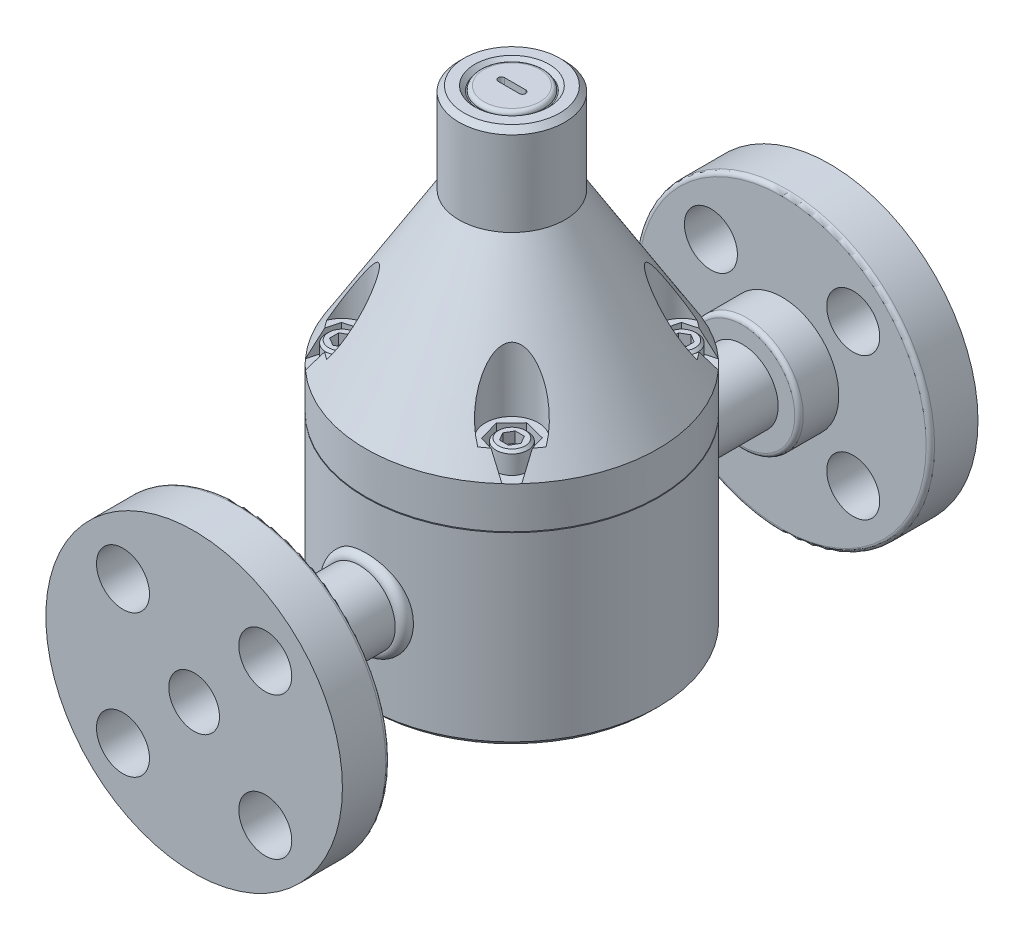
SolidWorks part; units mm, degrees
ref_plane "Front Plane" through (0, 0, 0) normal (0, 0, 1) x (1, 0, 0)
ref_plane "Top Plane" through (0, 0, 0) normal (0, 1, 0) x (1, 0, 0)
ref_plane "Right Plane" through (0, 0, 0) normal (1, 0, 0) x (0, 0, -1)
sketch "Sketch1" plane through (0, 0, 0) normal (0, 1, 0) x (1, 0, 0)
  circle A0 centre (0, 0) radius 43.815
  dimension "D1" = 87.63
extrude "Extrude1" add sketch "Sketch1" along normal blind 140.97
sketch "Sketch2" plane through (0, 0, 0) normal (0, 0, 1) x (1, 0, 0)
  line L0 (0, 0) -> (0, 140.97) construction
  line L1 (43.815, 140.97) -> (-43.815, 140.97) construction
  line L2 (-43.815, 56.134) -> (-43.815, 68.58)
  line L3 (-43.815, 56.134) -> (-30.226, 56.134)
  line L4 (-30.226, 56.134) -> (-30.226, 55.88)
  line L6 (-30.226, 55.88) -> (-49.4473, 55.88)
  line L7 (-49.4473, 55.88) -> (-49.4473, 147.034)
  line L8 (-49.4473, 147.034) -> (-15.875, 147.034)
  line L9 (-15.875, 147.034) -> (-15.875, 114.046)
  line L10 (-15.875, 114.046) -> (-43.815, 68.58)
  line L12 (-43.815, 0) -> (43.815, 0) construction
  dimension "D1" = 43.815
  dimension "D2" = 55.88
  dimension "D3" = 0.254
  dimension "D4" = 30.226
  dimension "D5" = 15.875
  dimension "D6" = 68.58
  dimension "D7" = 26.924
revolve "Cut-Revolve1" cut sketch "Sketch2" angle 360 about L0
ref_plane "Plane1" through (0, 140.97, 0) normal (0, 1, 0) x (-1, 0, 0)
sketch "Sketch3" plane through (0, 140.97, 0) normal (0, 1, 0) x (-1, 0, 0)
  circle A0 centre (0, 0) radius 11.1125
  dimension "D1" = 22.225
extrude "Extrude2" cut sketch "Sketch3" against normal blind 1.27 draft 45
chamfer "Chamfer1" distance 1.5748 angle 45 2 edges at (0, 0, 43.815) (0, 140.97, 15.875)
sketch "Sketch4" plane through (0, 140.97, 0) normal (0, 1, 0) x (-1, 0, 0)
  circle A0 centre (0, 0) radius 9.525
  dimension "D1" = 19.05
extrude "Extrude3" add sketch "Sketch4" against normal up to surface (1.27 mm away)
fillet "Fillet1" radius 1.143 1 edges at (0, 140.97, 9.525)
sketch "Sketch5" plane through (0, 140.97, 0) normal (0, 1, 0) x (-1, 0, 0)
  line L0 (-3.175, 0) -> (3.175, 0) construction
  line L1 (3.175, 0.9652) -> (-3.175, 0.9652)
  line L2 (-3.175, -0.9652) -> (3.175, -0.9652)
  arc A0 (-3.175, 0.9652) -> (-3.175, -0.9652) centre (-3.175, 0) ccw
  arc A1 (3.175, -0.9652) -> (3.175, 0.9652) centre (3.175, 0) ccw
  dimension "D1" = 3.175
  dimension "D2" = 6.35
  dimension "D3" = 0.9652
  dimension "D4" = 0.9652
extrude "Extrude4" cut sketch "Sketch5" against normal blind 3.302 draft 1
ref_plane "Plane2" through (0, 74.93, 0) normal (0, 1, 0) x (-1, 0, 0)
sketch "Sketch6" plane through (0, 74.93, 0) normal (0, 1, 0) x (-1, 0, 0)
  line L0 (0, 0) -> (-43.815, 0) construction
  line L1 (0, 0) -> (-30.9819, 30.9819) construction
  circle A0 centre (0, 0) radius 43.815 construction
  circle A1 centre (0, 0) radius 36.0045 construction
  circle A2 centre (-25.459, 25.459) radius 7.9375
  dimension "D1" = 72.009
  dimension "D2" = 15.875
extrude "Extrude5" cut sketch "Sketch6" along normal blind 22.86
sketch "Sketch8" plane through (0, 74.93, 0) normal (0, 1, 0) x (-1, 0, 0)
  line L0 (0, 0) -> (-30.9819, 30.9819) construction
  line L1 (-30.9819, 19.758) -> (-19.9362, 31.1601) construction
  line L2 (-30.9819, 30.9819) -> (-39.3973, 39.3973) construction
  line L3 (-29.9486, 20.8246) -> (-23.6903, 19.2537)
  line L4 (-23.6903, 19.2537) -> (-19.2007, 23.8882)
  line L5 (-19.2007, 23.8882) -> (-20.9694, 30.0935)
  line L9 (-29.9486, 20.8246) -> (-33.5917, 33.5917)
  line L10 (-33.5917, 33.5917) -> (-20.9694, 30.0935)
  line L12 (-27.2278, 31.6643) -> (-31.7174, 27.0299)
  line L13 (-20.9694, 30.0935) -> (-27.2278, 31.6643)
  line L14 (-31.7174, 27.0299) -> (-29.9486, 20.8246)
  circle A0 centre (0, 0) radius 43.815 construction
  arc A1 (-32.876, 22.6318) -> (-22.6318, 32.876) centre (-25.459, 25.459) ccw construction
  arc A2 (-32.876, 22.6318) -> (-22.6318, 32.876) centre (-25.459, 25.459) ccw construction
  circle A3 centre (-25.459, 25.459) radius 5.588 construction
extrude "Extrude6" cut sketch "Sketch8" against normal blind 6.35
pattern_circular "CirPattern1" count 4 over 360 about axis through (0, 0, 0) along (0, 1, 0) of "Extrude5", "Extrude6"
sketch "Sketch9" plane through (0, 74.93, 0) normal (0, 1, 0) x (-1, 0, 0)
  line L0 (0, 0) -> (-25.459, 25.459) construction
  circle A0 centre (-25.459, 25.459) radius 4.7625
  dimension "D1" = 9.525
extrude "Extrude7" add sketch "Sketch9" against normal up to surface (6.35 mm away)
sketch "Sketch10" plane through (0, 74.93, 0) normal (0, 1, 0) x (-1, 0, 0)
  line L1 (-28.1871, 25.459) -> (-26.8231, 23.0964)
  line L2 (-26.8231, 23.0964) -> (-24.095, 23.0964)
  line L3 (-24.095, 23.0964) -> (-22.7309, 25.459)
  line L4 (-22.7309, 25.459) -> (-24.095, 27.8216)
  line L5 (-24.095, 27.8216) -> (-26.8231, 27.8216)
  line L6 (-26.8231, 27.8216) -> (-28.1871, 25.459)
  circle A0 centre (-25.459, 25.459) radius 2.3626 construction
extrude "Extrude8" cut sketch "Sketch10" against normal blind 3.175
pattern_circular "CirPattern2" count 4 over 360 about axis through (0, 0, 0) along (0, 1, 0) of "Extrude7", "Extrude8"
chamfer "Chamfer2" distance 0.762 angle 45 4 edges at (-25.459, 74.93, -30.2215) (30.2215, 74.93, -25.459) (25.459, 74.93, 30.2215) (-30.2215, 74.93, 25.459)
ref_plane "Plane3" through (0, 0, 95.25) normal (0, 0, 1) x (1, 0, 0)
sketch "Sketch11" plane through (0, 0, 95.25) normal (0, 0, 1) x (1, 0, 0)
  line L0 (0, 0) -> (0, 140.97) construction
  line L1 (14.3002, 140.97) -> (-14.3002, 140.97) construction
  line L2 (-43.815, 28.575) -> (43.815, 28.575) construction
  line L3 (-43.815, 55.88) -> (-43.815, 1.5748) construction
  line L4 (43.815, 1.5748) -> (43.815, 55.88) construction
  line L5 (-42.2402, 0) -> (42.2402, 0) construction
  circle A0 centre (0, 28.575) radius 44.45
  dimension "D2" = 88.9
  dimension "D1" = 28.575
extrude "Boss-Extrude1" add sketch "Sketch11" against normal blind 14.2748 separate body
sketch "Sketch12" plane through (0, 0, 95.25) normal (0, 0, 1) x (1, 0, 0)
  circle A0 centre (0, 28.575) radius 17.018
  dimension "D1" = 34.036
extrude "Boss-Extrude2" add sketch "Sketch12" against normal blind 26.2128
sketch "Sketch13" plane through (0, 0, 95.25) normal (0, 0, 1) x (1, 0, 0)
  circle A0 centre (0, 28.575) radius 10.7696
  dimension "D1" = 21.5392
extrude "Boss-Extrude3" add sketch "Sketch13" against normal up to surface (52.7792 mm away)
sketch "Sketch14" plane through (0, 0, 95.25) normal (0, 0, 1) x (1, 0, 0)
  circle A0 centre (0, 28.575) radius 7.5946
  dimension "D1" = 15.1892
extrude "Cut-Extrude1" cut sketch "Sketch14" against normal blind 25.4
sketch "Sketch15" plane through (0, 0, 95.25) normal (0, 0, 1) x (1, 0, 0)
  line L0 (0, 28.575) -> (-44.45, 28.575) construction
  line L1 (0, 28.575) -> (-31.4309, 60.0059) construction
  circle A0 centre (0, 28.575) radius 44.45 construction
  circle A1 centre (0, 28.575) radius 30.1625 construction
  circle A2 centre (-21.3281, 49.9031) radius 7.9375
  dimension "D2" = 60.325
  dimension "D3" = 15.875
  dimension "D1" = 45
extrude "Cut-Extrude2" cut sketch "Sketch15" against normal blind 25.4
pattern_circular "CirPattern3" count 4 over 360 about axis through (0, 28.575, 0) along (0, 0, 1) of "Cut-Extrude2"
sketch "Sketch16" plane through (0, 0, 0) normal (1, 0, 0) x (0, 0, -1)
  line L0 (-41.2557, 38.1023) -> (-45.7371, 38.1023)
  line L1 (-45.7371, 38.1023) -> (-45.7371, 39.3446)
  line L2 (-43.815, 39.3446) -> (-69.0372, 39.3446) construction
  line L3 (-41.2557, 38.1023) -> (-41.2557, 39.7931)
  line L4 (-95.25, 28.575) -> (0, 28.575) construction
  line L5 (-95.25, 73.025) -> (-95.25, -15.875) construction
  arc A0 (-45.7371, 39.3446) -> (-41.2557, 39.7931) centre (-43.4739, 39.3446) cw
revolve "Revolve1" add sketch "Sketch16" angle 360 about L4
ref_plane "Plane4" through (0, 0, -95.25) normal (0, 0, 1) x (1, 0, 0)
sketch "Sketch18" plane through (0, 0, -95.25) normal (0, 0, 1) x (1, 0, 0)
  circle A0 centre (0, 28.575) radius 44.45
  dimension "D1" = 88.9
extrude "Boss-Extrude5" add sketch "Sketch18" along normal blind 14.2748 separate body
sketch "Sketch19" plane through (0, 0, -95.25) normal (0, 0, 1) x (1, 0, 0)
  circle A0 centre (0, 28.575) radius 17.018
  dimension "D1" = 34.036
extrude "Boss-Extrude6" add sketch "Sketch19" along normal blind 26.2128
sketch "Sketch20" plane through (0, 0, -95.25) normal (0, 0, 1) x (1, 0, 0)
  circle A0 centre (0, 28.575) radius 10.7696
extrude "Boss-Extrude7" add sketch "Sketch20" along normal up to surface (52.7792 mm away)
sketch "Sketch21" plane through (0, 0, -95.25) normal (0, 0, 1) x (1, 0, 0)
  circle A0 centre (0, 28.575) radius 7.5946
extrude "Cut-Extrude3" cut sketch "Sketch21" along normal blind 25.4
sketch "Sketch22" plane through (0, 0, -95.25) normal (0, 0, 1) x (1, 0, 0)
  circle A0 centre (21.3281, 49.9031) radius 7.9375
extrude "Cut-Extrude4" cut sketch "Sketch22" along normal blind 25.4
pattern_circular "CirPattern4" count 4 over 360 about axis through (0, 28.575, 0) along (0, 0, 1) of "Cut-Extrude4"
sketch "Sketch23" plane through (0, 0, 0) normal (1, 0, 0) x (0, 0, -1)
  line L0 (-43.815, 41.5819) -> (43.815, 41.5819) construction
  line L1 (43.815, 39.3446) -> (43.815, 55.88) construction
  line L2 (41.4718, 41.5819) -> (41.4718, 38.3439)
  line L3 (41.4718, 38.3439) -> (46.6699, 38.3439)
  line L4 (46.6699, 38.3439) -> (46.6699, 39.4206)
  line L5 (69.0372, 28.575) -> (41.4718, 28.575) construction
  line L6 (69.0372, 45.593) -> (69.0372, 11.557) construction
  arc A0 (46.6699, 39.4206) -> (41.4718, 41.5819) centre (43.6215, 39.4206) ccw
revolve "Revolve2" add sketch "Sketch23" angle 360 about L5
fillet "Fillet3" radius 1.27 4 edges at (44.45, 28.575, -80.9752) (17.018, 28.575, -69.0372) (17.018, 28.575, 69.0372) (44.45, 28.575, 80.9752)
